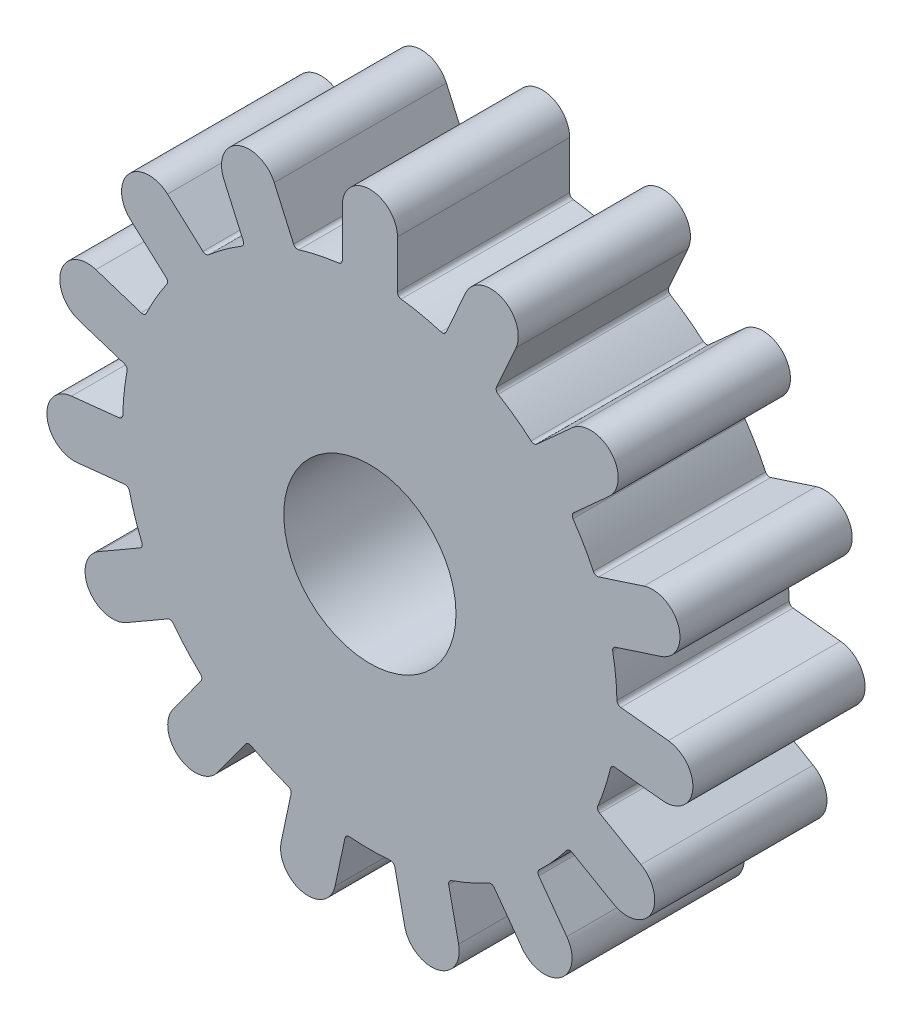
SolidWorks part; units mm, degrees
ref_plane "Front Plane" through (0, 0, 0) normal (0, 0, 1) x (1, 0, 0)
ref_plane "Top Plane" through (0, 0, 0) normal (0, 1, 0) x (1, 0, 0)
ref_plane "Right Plane" through (0, 0, 0) normal (1, 0, 0) x (0, 0, -1)
sketch "Sketch1" plane through (0, 0, 0) normal (0, 0, 1) x (1, 0, 0)
  line L0 (-1.6, 17.25) -> (-1.6, 14.4823)
  line L1 (1.6, 17.25) -> (1.6, 14.4823)
  line L2 (5.5545, 16.4094) -> (4.4288, 13.881)
  line L3 (8.4779, 15.1079) -> (7.3522, 12.5795)
  line L4 (11.7486, 12.7315) -> (9.6918, 10.8796)
  line L5 (13.8899, 10.3535) -> (11.8331, 8.5015)
  line L6 (15.9113, 6.8522) -> (13.2791, 5.997)
  line L7 (16.9002, 3.8089) -> (14.2679, 2.9536)
  line L8 (17.3227, -0.2119) -> (14.5702, 0.0774)
  line L9 (16.9883, -3.3944) -> (14.2357, -3.105)
  line L10 (15.7389, -7.2394) -> (13.3421, -5.8555)
  line L11 (14.1389, -10.0106) -> (11.7421, -8.6268)
  line L12 (11.4337, -13.0151) -> (9.8069, -10.776)
  line L13 (8.8449, -14.896) -> (7.2181, -12.6569)
  line L14 (5.1515, -16.5404) -> (4.5761, -13.8332)
  line L15 (2.0214, -17.2057) -> (1.446, -14.4985)
  line L16 (-2.0214, -17.2057) -> (-1.446, -14.4985)
  line L17 (-5.1515, -16.5404) -> (-4.5761, -13.8332)
  line L18 (-8.8449, -14.896) -> (-7.2181, -12.6569)
  line L19 (-11.4337, -13.0151) -> (-9.8069, -10.776)
  line L20 (-14.1389, -10.0106) -> (-11.7421, -8.6268)
  line L21 (-15.7389, -7.2394) -> (-13.3421, -5.8555)
  line L22 (-16.9883, -3.3944) -> (-14.2357, -3.105)
  line L23 (-17.3227, -0.2119) -> (-14.5702, 0.0774)
  line L24 (-16.9002, 3.8089) -> (-14.2679, 2.9536)
  line L25 (-15.9113, 6.8522) -> (-13.2791, 5.997)
  line L26 (-13.8899, 10.3535) -> (-11.8331, 8.5015)
  line L27 (-11.7486, 12.7315) -> (-9.6918, 10.8796)
  line L28 (-8.4779, 15.1079) -> (-7.3522, 12.5795)
  line L29 (-5.5545, 16.4094) -> (-4.4288, 13.881)
  arc A0 (-1.8183, 14.2343) -> (-4.1285, 13.7433) centre (0, 0) ccw
  arc A1 (4.1285, 13.7433) -> (4.4288, 13.881) centre (4.2004, 13.9827) ccw
  arc A2 (1.6, 17.25) -> (-1.6, 17.25) centre (0, 17.25) ccw
  arc A3 (1.6, 14.4823) -> (1.8183, 14.2343) centre (1.85, 14.4823) ccw
  arc A4 (-1.8183, 14.2343) -> (-1.6, 14.4823) centre (-1.85, 14.4823) ccw
  arc A5 (8.4779, 15.1079) -> (5.5545, 16.4094) centre (7.0162, 15.7587) ccw
  arc A6 (7.3522, 12.5795) -> (7.4507, 12.2641) centre (7.5805, 12.4778) ccw
  arc A7 (9.3615, 10.8759) -> (9.6918, 10.8796) centre (9.5246, 11.0654) ccw
  arc A8 (13.8899, 10.3535) -> (11.7486, 12.7315) centre (12.8192, 11.5425) ccw
  arc A9 (11.8331, 8.5015) -> (11.7949, 8.1734) centre (12.0004, 8.3157) ccw
  arc A10 (12.9758, 6.128) -> (13.2791, 5.997) centre (13.2018, 6.2347) ccw
  arc A11 (16.9002, 3.8089) -> (15.9113, 6.8522) centre (16.4057, 5.3305) ccw
  arc A12 (14.2679, 2.9536) -> (14.0995, 2.6693) centre (14.3452, 2.7158) ccw
  arc A13 (14.3464, 0.3205) -> (14.5702, 0.0774) centre (14.5964, 0.3261) ccw
  arc A14 (16.9883, -3.3944) -> (17.3227, -0.2119) centre (17.1555, -1.8031) ccw
  arc A15 (14.2357, -3.105) -> (13.9663, -3.2963) centre (14.2096, -3.3537) ccw
  arc A16 (13.2365, -5.5425) -> (13.3421, -5.8555) centre (13.4671, -5.639) ccw
  arc A17 (14.1389, -10.0106) -> (15.7389, -7.2394) centre (14.9389, -8.625) ccw
  arc A18 (11.7421, -8.6268) -> (11.4181, -8.6919) centre (11.6171, -8.8433) ccw
  arc A19 (9.8378, -10.447) -> (9.8069, -10.776) centre (10.0092, -10.629) ccw
  arc A20 (8.8449, -14.896) -> (11.4337, -13.0151) centre (10.1393, -13.9555) ccw
  arc A21 (7.2181, -12.6569) -> (6.8957, -12.5846) centre (7.0158, -12.8038) ccw
  arc A22 (4.7381, -13.5452) -> (4.5761, -13.8332) centre (4.8206, -13.7812) ccw
  arc A23 (2.0214, -17.2057) -> (5.1515, -16.5404) centre (3.5865, -16.873) ccw
  arc A24 (1.446, -14.4985) -> (1.1809, -14.3013) centre (1.2015, -14.5505) ccw
  arc A25 (-1.1809, -14.3013) -> (-1.446, -14.4985) centre (-1.2015, -14.5505) ccw
  arc A26 (-5.1515, -16.5404) -> (-2.0214, -17.2057) centre (-3.5865, -16.873) ccw
  arc A27 (-4.5761, -13.8332) -> (-4.7381, -13.5452) centre (-4.8206, -13.7812) ccw
  arc A28 (-6.8957, -12.5846) -> (-7.2181, -12.6569) centre (-7.0158, -12.8038) ccw
  arc A29 (-11.4337, -13.0151) -> (-8.8449, -14.896) centre (-10.1393, -13.9555) ccw
  arc A30 (-9.8069, -10.776) -> (-9.8378, -10.447) centre (-10.0092, -10.629) ccw
  arc A31 (-11.4181, -8.6919) -> (-11.7421, -8.6268) centre (-11.6171, -8.8433) ccw
  arc A32 (-15.7389, -7.2394) -> (-14.1389, -10.0106) centre (-14.9389, -8.625) ccw
  arc A33 (-13.3421, -5.8555) -> (-13.2365, -5.5425) centre (-13.4671, -5.639) ccw
  arc A34 (-13.9663, -3.2963) -> (-14.2357, -3.105) centre (-14.2096, -3.3537) ccw
  arc A35 (-17.3227, -0.2119) -> (-16.9883, -3.3944) centre (-17.1555, -1.8031) ccw
  arc A36 (-14.5702, 0.0774) -> (-14.3464, 0.3205) centre (-14.5964, 0.3261) ccw
  arc A37 (-14.0995, 2.6693) -> (-14.2679, 2.9536) centre (-14.3452, 2.7158) ccw
  arc A38 (-15.9113, 6.8522) -> (-16.9002, 3.8089) centre (-16.4057, 5.3305) ccw
  arc A39 (-13.2791, 5.997) -> (-12.9758, 6.128) centre (-13.2018, 6.2347) ccw
  arc A40 (-11.7949, 8.1734) -> (-11.8331, 8.5015) centre (-12.0004, 8.3157) ccw
  arc A41 (-11.7486, 12.7315) -> (-13.8899, 10.3535) centre (-12.8192, 11.5425) ccw
  arc A42 (-9.6918, 10.8796) -> (-9.3615, 10.8759) centre (-9.5246, 11.0654) ccw
  arc A43 (-7.4507, 12.2641) -> (-7.3522, 12.5795) centre (-7.5805, 12.4778) ccw
  arc A44 (-5.5545, 16.4094) -> (-8.4779, 15.1079) centre (-7.0162, 15.7587) ccw
  arc A45 (-4.4288, 13.881) -> (-4.1285, 13.7433) centre (-4.2004, 13.9827) ccw
  arc A46 (-7.4507, 12.2641) -> (-9.3615, 10.8759) centre (0, 0) ccw
  arc A47 (-11.7949, 8.1734) -> (-12.9758, 6.128) centre (0, 0) ccw
  arc A48 (4.1285, 13.7433) -> (1.8183, 14.2343) centre (0, 0) ccw
  arc A49 (9.3615, 10.8759) -> (7.4507, 12.2641) centre (0, 0) ccw
  arc A50 (12.9758, 6.128) -> (11.7949, 8.1734) centre (0, 0) ccw
  arc A51 (-14.0995, 2.6693) -> (-14.3464, 0.3205) centre (0, 0) ccw
  arc A52 (-13.9663, -3.2963) -> (-13.2365, -5.5425) centre (0, 0) ccw
  arc A53 (-11.4181, -8.6919) -> (-9.8378, -10.447) centre (0, 0) ccw
  arc A54 (-6.8957, -12.5846) -> (-4.7381, -13.5452) centre (0, 0) ccw
  arc A55 (-1.1809, -14.3013) -> (1.1809, -14.3013) centre (0, 0) ccw
  arc A56 (4.7381, -13.5452) -> (6.8957, -12.5846) centre (0, 0) ccw
  arc A57 (9.8378, -10.447) -> (11.4181, -8.6919) centre (0, 0) ccw
  arc A58 (13.2365, -5.5425) -> (13.9663, -3.2963) centre (0, 0) ccw
  arc A59 (14.3464, 0.3205) -> (14.0995, 2.6693) centre (0, 0) ccw
  circle A60 centre (0, 0) radius 5
  point P140 (0, 0)
  dimension "D1" = 15
  dimension "D2" = 28.7
  dimension "D3" = 3.2
  dimension "D4" = 0.25
  dimension "D5" = 10
extrude "Boss-Extrude1" add sketch "Sketch1" along normal blind 10
